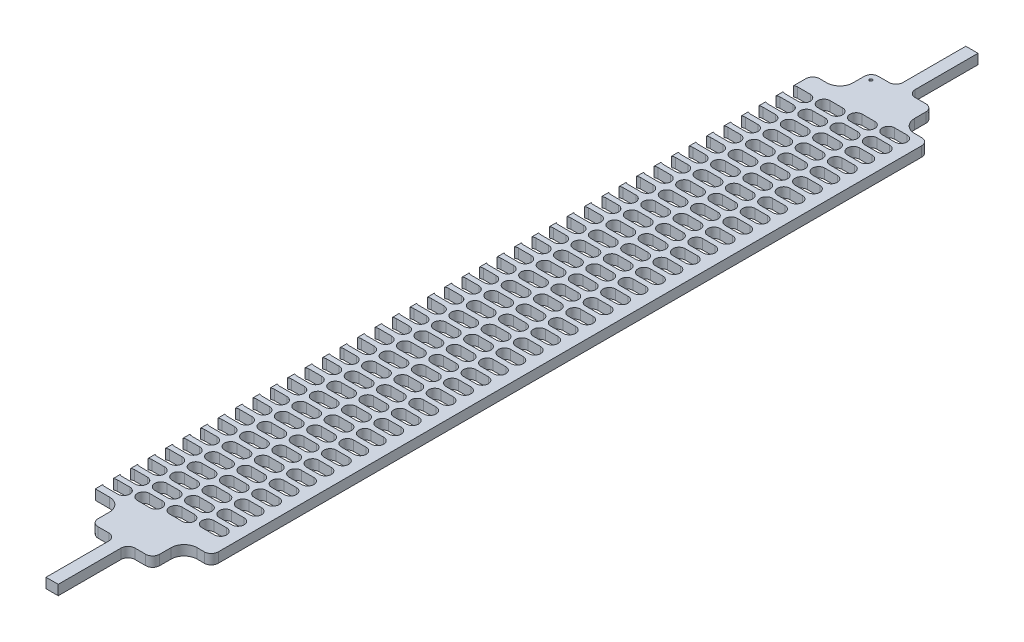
SolidWorks part; units mm, degrees
ref_plane "Alzado" through (0, 0, 0) normal (0, 0, 1) x (1, 0, 0)
ref_plane "Planta" through (0, 0, 0) normal (0, 1, 0) x (1, 0, 0)
ref_plane "Vista lateral" through (0, 0, 0) normal (1, 0, 0) x (0, 0, -1)
sketch "Croquis1" plane through (0, 0, 0) normal (0, 1, 0) x (1, 0, 0)
  line L0 (15.6, 411.2) -> (15.6, 429.2)
  line L1 (0, 0) -> (15.6, 0)
  line L2 (0, 0) -> (0, 4.2983)
  line L3 (0, 411.2) -> (15.6, 411.2)
  line L4 (66.5, 0) -> (66.5, 411.2)
  line L5 (15.6, 429.2) -> (29.75, 429.2)
  line L6 (29.75, 429.2) -> (29.75, 469.2)
  line L7 (29.75, 469.2) -> (36.75, 469.2)
  line L8 (36.75, 469.2) -> (36.75, 429.2)
  line L9 (36.75, 429.2) -> (50.9, 429.2)
  line L10 (50.9, 429.2) -> (50.9, 411.2)
  line L11 (50.9, 411.2) -> (66.5, 411.2)
  line L12 (15.6, 420.2) -> (50.9, 420.2) construction
  line L13 (50.9, 0) -> (50.9, -18)
  line L20 (50.9, -18) -> (36.75, -18)
  line L21 (36.75, -18) -> (36.75, -58)
  line L22 (36.75, -58) -> (29.75, -58)
  line L23 (29.75, -58) -> (29.75, -18)
  line L24 (29.75, -18) -> (15.6, -18)
  line L25 (15.6, -18) -> (15.6, 0)
  line L26 (50.9, 0) -> (66.5, 0)
  line L27 (15.6, -9) -> (50.9, -9) construction
  line L28 (49.8, 408.3) -> (57, 408.3)
  line L35 (49.8, 401.3) -> (57, 401.3)
  line L36 (33.8, 398.8) -> (41, 398.8)
  line L37 (33.8, 405.8) -> (41, 405.8)
  line L38 (17.8, 396.3) -> (25, 396.3)
  line L39 (17.8, 403.3) -> (25, 403.3)
  line L40 (1.8, 393.8) -> (9, 393.8)
  line L41 (1.8, 400.8) -> (9, 400.8)
  line L42 (0, 400.3017) -> (0, 411.2)
  line L43 (49.8, 398.3) -> (57, 398.3)
  line L44 (49.8, 391.3) -> (57, 391.3)
  line L45 (33.8, 395.8) -> (41, 395.8)
  line L46 (33.8, 388.8) -> (41, 388.8)
  line L47 (17.8, 393.3) -> (25, 393.3)
  line L48 (17.8, 386.3) -> (25, 386.3)
  line L49 (1.8, 390.8) -> (9, 390.8)
  line L50 (1.8, 383.8) -> (9, 383.8)
  line L51 (49.8, 388.3) -> (57, 388.3)
  line L52 (49.8, 381.3) -> (57, 381.3)
  line L53 (33.8, 385.8) -> (41, 385.8)
  line L54 (33.8, 378.8) -> (41, 378.8)
  line L55 (17.8, 383.3) -> (25, 383.3)
  line L56 (17.8, 376.3) -> (25, 376.3)
  line L57 (1.8, 380.8) -> (9, 380.8)
  line L58 (1.8, 373.8) -> (9, 373.8)
  line L59 (49.8, 378.3) -> (57, 378.3)
  line L60 (49.8, 371.3) -> (57, 371.3)
  line L61 (33.8, 375.8) -> (41, 375.8)
  line L62 (33.8, 368.8) -> (41, 368.8)
  line L63 (17.8, 373.3) -> (25, 373.3)
  line L64 (17.8, 366.3) -> (25, 366.3)
  line L65 (1.8, 370.8) -> (9, 370.8)
  line L66 (1.8, 363.8) -> (9, 363.8)
  line L67 (49.8, 368.3) -> (57, 368.3)
  line L68 (49.8, 361.3) -> (57, 361.3)
  line L69 (33.8, 365.8) -> (41, 365.8)
  line L70 (33.8, 358.8) -> (41, 358.8)
  line L71 (17.8, 363.3) -> (25, 363.3)
  line L72 (17.8, 356.3) -> (25, 356.3)
  line L73 (1.8, 360.8) -> (9, 360.8)
  line L74 (1.8, 353.8) -> (9, 353.8)
  line L75 (49.8, 358.3) -> (57, 358.3)
  line L76 (49.8, 351.3) -> (57, 351.3)
  line L77 (33.8, 355.8) -> (41, 355.8)
  line L78 (33.8, 348.8) -> (41, 348.8)
  line L79 (17.8, 353.3) -> (25, 353.3)
  line L80 (17.8, 346.3) -> (25, 346.3)
  line L81 (1.8, 350.8) -> (9, 350.8)
  line L82 (1.8, 343.8) -> (9, 343.8)
  line L83 (49.8, 348.3) -> (57, 348.3)
  line L84 (49.8, 341.3) -> (57, 341.3)
  line L85 (33.8, 345.8) -> (41, 345.8)
  line L86 (33.8, 338.8) -> (41, 338.8)
  line L87 (17.8, 343.3) -> (25, 343.3)
  line L88 (17.8, 336.3) -> (25, 336.3)
  line L89 (1.8, 340.8) -> (9, 340.8)
  line L90 (1.8, 333.8) -> (9, 333.8)
  line L91 (49.8, 338.3) -> (57, 338.3)
  line L92 (49.8, 331.3) -> (57, 331.3)
  line L93 (33.8, 335.8) -> (41, 335.8)
  line L94 (33.8, 328.8) -> (41, 328.8)
  line L95 (17.8, 333.3) -> (25, 333.3)
  line L96 (17.8, 326.3) -> (25, 326.3)
  line L97 (1.8, 330.8) -> (9, 330.8)
  line L98 (1.8, 323.8) -> (9, 323.8)
  line L99 (49.8, 328.3) -> (57, 328.3)
  line L100 (49.8, 321.3) -> (57, 321.3)
  line L101 (33.8, 325.8) -> (41, 325.8)
  line L102 (33.8, 318.8) -> (41, 318.8)
  line L103 (17.8, 323.3) -> (25, 323.3)
  line L104 (17.8, 316.3) -> (25, 316.3)
  line L105 (1.8, 320.8) -> (9, 320.8)
  line L106 (1.8, 313.8) -> (9, 313.8)
  line L107 (49.8, 318.3) -> (57, 318.3)
  line L108 (49.8, 311.3) -> (57, 311.3)
  line L109 (33.8, 315.8) -> (41, 315.8)
  line L110 (33.8, 308.8) -> (41, 308.8)
  line L111 (17.8, 313.3) -> (25, 313.3)
  line L112 (17.8, 306.3) -> (25, 306.3)
  line L113 (1.8, 310.8) -> (9, 310.8)
  line L114 (1.8, 303.8) -> (9, 303.8)
  line L115 (49.8, 308.3) -> (57, 308.3)
  line L116 (49.8, 301.3) -> (57, 301.3)
  line L117 (33.8, 305.8) -> (41, 305.8)
  line L118 (33.8, 298.8) -> (41, 298.8)
  line L119 (17.8, 303.3) -> (25, 303.3)
  line L120 (17.8, 296.3) -> (25, 296.3)
  line L121 (1.8, 300.8) -> (9, 300.8)
  line L122 (1.8, 293.8) -> (9, 293.8)
  line L123 (49.8, 298.3) -> (57, 298.3)
  line L124 (49.8, 291.3) -> (57, 291.3)
  line L125 (33.8, 295.8) -> (41, 295.8)
  line L126 (33.8, 288.8) -> (41, 288.8)
  line L127 (17.8, 293.3) -> (25, 293.3)
  line L128 (17.8, 286.3) -> (25, 286.3)
  line L129 (1.8, 290.8) -> (9, 290.8)
  line L130 (1.8, 283.8) -> (9, 283.8)
  line L131 (49.8, 288.3) -> (57, 288.3)
  line L132 (49.8, 281.3) -> (57, 281.3)
  line L133 (33.8, 285.8) -> (41, 285.8)
  line L134 (33.8, 278.8) -> (41, 278.8)
  line L135 (17.8, 283.3) -> (25, 283.3)
  line L136 (17.8, 276.3) -> (25, 276.3)
  line L137 (1.8, 280.8) -> (9, 280.8)
  line L138 (1.8, 273.8) -> (9, 273.8)
  line L139 (49.8, 278.3) -> (57, 278.3)
  line L140 (49.8, 271.3) -> (57, 271.3)
  line L141 (33.8, 275.8) -> (41, 275.8)
  line L142 (33.8, 268.8) -> (41, 268.8)
  line L143 (17.8, 273.3) -> (25, 273.3)
  line L144 (17.8, 266.3) -> (25, 266.3)
  line L145 (1.8, 270.8) -> (9, 270.8)
  line L146 (1.8, 263.8) -> (9, 263.8)
  line L147 (49.8, 268.3) -> (57, 268.3)
  line L148 (49.8, 261.3) -> (57, 261.3)
  line L149 (33.8, 265.8) -> (41, 265.8)
  line L150 (33.8, 258.8) -> (41, 258.8)
  line L151 (17.8, 263.3) -> (25, 263.3)
  line L152 (17.8, 256.3) -> (25, 256.3)
  line L153 (1.8, 260.8) -> (9, 260.8)
  line L154 (1.8, 253.8) -> (9, 253.8)
  line L155 (49.8, 258.3) -> (57, 258.3)
  line L156 (49.8, 251.3) -> (57, 251.3)
  line L157 (33.8, 255.8) -> (41, 255.8)
  line L158 (33.8, 248.8) -> (41, 248.8)
  line L159 (17.8, 253.3) -> (25, 253.3)
  line L160 (17.8, 246.3) -> (25, 246.3)
  line L161 (1.8, 250.8) -> (9, 250.8)
  line L162 (1.8, 243.8) -> (9, 243.8)
  line L163 (49.8, 248.3) -> (57, 248.3)
  line L164 (49.8, 241.3) -> (57, 241.3)
  line L165 (33.8, 245.8) -> (41, 245.8)
  line L166 (33.8, 238.8) -> (41, 238.8)
  line L167 (17.8, 243.3) -> (25, 243.3)
  line L168 (17.8, 236.3) -> (25, 236.3)
  line L169 (1.8, 240.8) -> (9, 240.8)
  line L170 (1.8, 233.8) -> (9, 233.8)
  line L171 (49.8, 238.3) -> (57, 238.3)
  line L172 (49.8, 231.3) -> (57, 231.3)
  line L173 (33.8, 235.8) -> (41, 235.8)
  line L174 (33.8, 228.8) -> (41, 228.8)
  line L175 (17.8, 233.3) -> (25, 233.3)
  line L176 (17.8, 226.3) -> (25, 226.3)
  line L177 (1.8, 230.8) -> (9, 230.8)
  line L178 (1.8, 223.8) -> (9, 223.8)
  line L179 (49.8, 228.3) -> (57, 228.3)
  line L180 (49.8, 221.3) -> (57, 221.3)
  line L181 (33.8, 225.8) -> (41, 225.8)
  line L182 (33.8, 218.8) -> (41, 218.8)
  line L183 (17.8, 223.3) -> (25, 223.3)
  line L184 (17.8, 216.3) -> (25, 216.3)
  line L185 (1.8, 220.8) -> (9, 220.8)
  line L186 (1.8, 213.8) -> (9, 213.8)
  line L187 (49.8, 218.3) -> (57, 218.3)
  line L188 (49.8, 211.3) -> (57, 211.3)
  line L189 (33.8, 215.8) -> (41, 215.8)
  line L190 (33.8, 208.8) -> (41, 208.8)
  line L191 (17.8, 213.3) -> (25, 213.3)
  line L192 (17.8, 206.3) -> (25, 206.3)
  line L193 (1.8, 210.8) -> (9, 210.8)
  line L194 (1.8, 203.8) -> (9, 203.8)
  line L195 (49.8, 208.3) -> (57, 208.3)
  line L196 (49.8, 201.3) -> (57, 201.3)
  line L197 (33.8, 205.8) -> (41, 205.8)
  line L198 (33.8, 198.8) -> (41, 198.8)
  line L199 (17.8, 203.3) -> (25, 203.3)
  line L200 (17.8, 196.3) -> (25, 196.3)
  line L201 (1.8, 200.8) -> (9, 200.8)
  line L202 (1.8, 193.8) -> (9, 193.8)
  line L203 (49.8, 198.3) -> (57, 198.3)
  line L204 (49.8, 191.3) -> (57, 191.3)
  line L205 (33.8, 195.8) -> (41, 195.8)
  line L206 (33.8, 188.8) -> (41, 188.8)
  line L207 (17.8, 193.3) -> (25, 193.3)
  line L208 (17.8, 186.3) -> (25, 186.3)
  line L209 (1.8, 190.8) -> (9, 190.8)
  line L210 (1.8, 183.8) -> (9, 183.8)
  line L211 (49.8, 188.3) -> (57, 188.3)
  line L212 (49.8, 181.3) -> (57, 181.3)
  line L213 (33.8, 185.8) -> (41, 185.8)
  line L214 (33.8, 178.8) -> (41, 178.8)
  line L215 (17.8, 183.3) -> (25, 183.3)
  line L216 (17.8, 176.3) -> (25, 176.3)
  line L217 (1.8, 180.8) -> (9, 180.8)
  line L218 (1.8, 173.8) -> (9, 173.8)
  line L219 (49.8, 178.3) -> (57, 178.3)
  line L220 (49.8, 171.3) -> (57, 171.3)
  line L221 (33.8, 175.8) -> (41, 175.8)
  line L222 (33.8, 168.8) -> (41, 168.8)
  line L223 (17.8, 173.3) -> (25, 173.3)
  line L224 (17.8, 166.3) -> (25, 166.3)
  line L225 (1.8, 170.8) -> (9, 170.8)
  line L226 (1.8, 163.8) -> (9, 163.8)
  line L227 (49.8, 168.3) -> (57, 168.3)
  line L228 (49.8, 161.3) -> (57, 161.3)
  line L229 (33.8, 165.8) -> (41, 165.8)
  line L230 (33.8, 158.8) -> (41, 158.8)
  line L231 (17.8, 163.3) -> (25, 163.3)
  line L232 (17.8, 156.3) -> (25, 156.3)
  line L233 (1.8, 160.8) -> (9, 160.8)
  line L234 (1.8, 153.8) -> (9, 153.8)
  line L235 (49.8, 158.3) -> (57, 158.3)
  line L236 (49.8, 151.3) -> (57, 151.3)
  line L237 (33.8, 155.8) -> (41, 155.8)
  line L238 (33.8, 148.8) -> (41, 148.8)
  line L239 (17.8, 153.3) -> (25, 153.3)
  line L240 (17.8, 146.3) -> (25, 146.3)
  line L241 (1.8, 150.8) -> (9, 150.8)
  line L242 (1.8, 143.8) -> (9, 143.8)
  line L243 (49.8, 148.3) -> (57, 148.3)
  line L244 (49.8, 141.3) -> (57, 141.3)
  line L245 (33.8, 145.8) -> (41, 145.8)
  line L246 (33.8, 138.8) -> (41, 138.8)
  line L247 (17.8, 143.3) -> (25, 143.3)
  line L248 (17.8, 136.3) -> (25, 136.3)
  line L249 (1.8, 140.8) -> (9, 140.8)
  line L250 (1.8, 133.8) -> (9, 133.8)
  line L251 (49.8, 138.3) -> (57, 138.3)
  line L252 (49.8, 131.3) -> (57, 131.3)
  line L253 (33.8, 135.8) -> (41, 135.8)
  line L254 (33.8, 128.8) -> (41, 128.8)
  line L255 (17.8, 133.3) -> (25, 133.3)
  line L256 (17.8, 126.3) -> (25, 126.3)
  line L257 (1.8, 130.8) -> (9, 130.8)
  line L258 (1.8, 123.8) -> (9, 123.8)
  line L259 (49.8, 128.3) -> (57, 128.3)
  line L260 (49.8, 121.3) -> (57, 121.3)
  line L261 (33.8, 125.8) -> (41, 125.8)
  line L262 (33.8, 118.8) -> (41, 118.8)
  line L263 (17.8, 123.3) -> (25, 123.3)
  line L264 (17.8, 116.3) -> (25, 116.3)
  line L265 (1.8, 120.8) -> (9, 120.8)
  line L266 (1.8, 113.8) -> (9, 113.8)
  line L267 (49.8, 118.3) -> (57, 118.3)
  line L268 (49.8, 111.3) -> (57, 111.3)
  line L269 (33.8, 115.8) -> (41, 115.8)
  line L270 (33.8, 108.8) -> (41, 108.8)
  line L271 (17.8, 113.3) -> (25, 113.3)
  line L272 (17.8, 106.3) -> (25, 106.3)
  line L273 (1.8, 110.8) -> (9, 110.8)
  line L274 (1.8, 103.8) -> (9, 103.8)
  line L275 (49.8, 108.3) -> (57, 108.3)
  line L276 (49.8, 101.3) -> (57, 101.3)
  line L277 (33.8, 105.8) -> (41, 105.8)
  line L278 (33.8, 98.8) -> (41, 98.8)
  line L279 (17.8, 103.3) -> (25, 103.3)
  line L280 (17.8, 96.3) -> (25, 96.3)
  line L281 (1.8, 100.8) -> (9, 100.8)
  line L282 (1.8, 93.8) -> (9, 93.8)
  line L283 (49.8, 98.3) -> (57, 98.3)
  line L284 (49.8, 91.3) -> (57, 91.3)
  line L285 (33.8, 95.8) -> (41, 95.8)
  line L286 (33.8, 88.8) -> (41, 88.8)
  line L287 (17.8, 93.3) -> (25, 93.3)
  line L288 (17.8, 86.3) -> (25, 86.3)
  line L289 (1.8, 90.8) -> (9, 90.8)
  line L290 (1.8, 83.8) -> (9, 83.8)
  line L291 (49.8, 88.3) -> (57, 88.3)
  line L292 (49.8, 81.3) -> (57, 81.3)
  line L293 (33.8, 85.8) -> (41, 85.8)
  line L294 (33.8, 78.8) -> (41, 78.8)
  line L295 (17.8, 83.3) -> (25, 83.3)
  line L296 (17.8, 76.3) -> (25, 76.3)
  line L297 (1.8, 80.8) -> (9, 80.8)
  line L298 (1.8, 73.8) -> (9, 73.8)
  line L299 (49.8, 78.3) -> (57, 78.3)
  line L300 (49.8, 71.3) -> (57, 71.3)
  line L301 (33.8, 75.8) -> (41, 75.8)
  line L302 (33.8, 68.8) -> (41, 68.8)
  line L303 (17.8, 73.3) -> (25, 73.3)
  line L304 (17.8, 66.3) -> (25, 66.3)
  line L305 (1.8, 70.8) -> (9, 70.8)
  line L306 (1.8, 63.8) -> (9, 63.8)
  line L307 (49.8, 68.3) -> (57, 68.3)
  line L308 (49.8, 61.3) -> (57, 61.3)
  line L309 (33.8, 65.8) -> (41, 65.8)
  line L310 (33.8, 58.8) -> (41, 58.8)
  line L311 (17.8, 63.3) -> (25, 63.3)
  line L312 (17.8, 56.3) -> (25, 56.3)
  line L313 (1.8, 60.8) -> (9, 60.8)
  line L314 (1.8, 53.8) -> (9, 53.8)
  line L315 (49.8, 58.3) -> (57, 58.3)
  line L316 (49.8, 51.3) -> (57, 51.3)
  line L317 (33.8, 55.8) -> (41, 55.8)
  line L318 (33.8, 48.8) -> (41, 48.8)
  line L319 (17.8, 53.3) -> (25, 53.3)
  line L320 (17.8, 46.3) -> (25, 46.3)
  line L321 (1.8, 50.8) -> (9, 50.8)
  line L322 (1.8, 43.8) -> (9, 43.8)
  line L323 (49.8, 48.3) -> (57, 48.3)
  line L324 (49.8, 41.3) -> (57, 41.3)
  line L325 (33.8, 45.8) -> (41, 45.8)
  line L326 (33.8, 38.8) -> (41, 38.8)
  line L327 (17.8, 43.3) -> (25, 43.3)
  line L328 (17.8, 36.3) -> (25, 36.3)
  line L329 (1.8, 40.8) -> (9, 40.8)
  line L330 (1.8, 33.8) -> (9, 33.8)
  line L331 (49.8, 38.3) -> (57, 38.3)
  line L332 (49.8, 31.3) -> (57, 31.3)
  line L333 (33.8, 35.8) -> (41, 35.8)
  line L334 (33.8, 28.8) -> (41, 28.8)
  line L335 (17.8, 33.3) -> (25, 33.3)
  line L336 (17.8, 26.3) -> (25, 26.3)
  line L337 (1.8, 30.8) -> (9, 30.8)
  line L338 (1.8, 23.8) -> (9, 23.8)
  line L339 (49.8, 28.3) -> (57, 28.3)
  line L340 (49.8, 21.3) -> (57, 21.3)
  line L341 (33.8, 25.8) -> (41, 25.8)
  line L342 (33.8, 18.8) -> (41, 18.8)
  line L343 (17.8, 23.3) -> (25, 23.3)
  line L344 (17.8, 16.3) -> (25, 16.3)
  line L345 (1.8, 20.8) -> (9, 20.8)
  line L346 (1.8, 13.8) -> (9, 13.8)
  line L347 (49.8, 18.3) -> (57, 18.3)
  line L348 (49.8, 11.3) -> (57, 11.3)
  line L349 (33.8, 15.8) -> (41, 15.8)
  line L350 (33.8, 8.8) -> (41, 8.8)
  line L351 (17.8, 13.3) -> (25, 13.3)
  line L352 (17.8, 6.3) -> (25, 6.3)
  line L353 (1.8, 10.8) -> (9, 10.8)
  line L354 (1.8, 3.8) -> (9, 3.8)
  line L355 (0, 10.3017) -> (0, 14.2983)
  line L356 (0, 20.3017) -> (0, 24.2983)
  line L357 (0, 30.3017) -> (0, 34.2983)
  line L358 (0, 40.3017) -> (0, 44.2983)
  line L359 (0, 50.3017) -> (0, 54.2983)
  line L360 (0, 60.3017) -> (0, 64.2983)
  line L361 (0, 70.3017) -> (0, 74.2983)
  line L362 (0, 80.3017) -> (0, 84.2983)
  line L363 (0, 90.3017) -> (0, 94.2983)
  line L364 (0, 100.3017) -> (0, 104.2983)
  line L365 (0, 110.3017) -> (0, 114.2983)
  line L366 (0, 120.3017) -> (0, 124.2983)
  line L367 (0, 130.3017) -> (0, 134.2983)
  line L368 (0, 140.3017) -> (0, 144.2983)
  line L369 (0, 150.3017) -> (0, 154.2983)
  line L370 (0, 160.3017) -> (0, 164.2983)
  line L371 (0, 170.3017) -> (0, 174.2983)
  line L372 (0, 180.3017) -> (0, 184.2983)
  line L373 (0, 190.3017) -> (0, 194.2983)
  line L374 (0, 200.3017) -> (0, 204.2983)
  line L375 (0, 210.3017) -> (0, 214.2983)
  line L376 (0, 220.3017) -> (0, 224.2983)
  line L377 (0, 230.3017) -> (0, 234.2983)
  line L378 (0, 240.3017) -> (0, 244.2983)
  line L379 (0, 250.3017) -> (0, 254.2983)
  line L380 (0, 260.3017) -> (0, 264.2983)
  line L381 (0, 270.3017) -> (0, 274.2983)
  line L382 (0, 280.3017) -> (0, 284.2983)
  line L383 (0, 290.3017) -> (0, 294.2983)
  line L384 (0, 300.3017) -> (0, 304.2983)
  line L385 (0, 310.3017) -> (0, 314.2983)
  line L386 (0, 320.3017) -> (0, 324.2983)
  line L387 (0, 330.3017) -> (0, 334.2983)
  line L388 (0, 340.3017) -> (0, 344.2983)
  line L389 (0, 350.3017) -> (0, 354.2983)
  line L390 (0, 360.3017) -> (0, 364.2983)
  line L391 (0, 370.3017) -> (0, 374.2983)
  line L392 (0, 380.3017) -> (0, 384.2983)
  line L393 (0, 390.3017) -> (0, 394.2983)
  arc A0 (57, 401.3) -> (57, 408.3) centre (57, 404.8) ccw
  arc A1 (49.8, 408.3) -> (49.8, 401.3) centre (49.8, 404.8) ccw
  arc A2 (41, 398.8) -> (41, 405.8) centre (41, 402.3) ccw
  arc A3 (33.8, 405.8) -> (33.8, 398.8) centre (33.8, 402.3) ccw
  arc A4 (25, 396.3) -> (25, 403.3) centre (25, 399.8) ccw
  arc A5 (17.8, 403.3) -> (17.8, 396.3) centre (17.8, 399.8) ccw
  arc A6 (9, 393.8) -> (9, 400.8) centre (9, 397.3) ccw
  arc A7 (1.8, 400.8) -> (0, 400.3017) centre (1.8, 397.3) ccw
  arc A8 (0, 394.2983) -> (1.8, 393.8) centre (1.8, 397.3) ccw
  arc A9 (57, 391.3) -> (57, 398.3) centre (57, 394.8) ccw
  arc A10 (49.8, 398.3) -> (49.8, 391.3) centre (49.8, 394.8) ccw
  arc A11 (41, 388.8) -> (41, 395.8) centre (41, 392.3) ccw
  arc A12 (33.8, 395.8) -> (33.8, 388.8) centre (33.8, 392.3) ccw
  arc A13 (25, 386.3) -> (25, 393.3) centre (25, 389.8) ccw
  arc A14 (17.8, 393.3) -> (17.8, 386.3) centre (17.8, 389.8) ccw
  arc A15 (9, 383.8) -> (9, 390.8) centre (9, 387.3) ccw
  arc A16 (1.8, 390.8) -> (0, 390.3017) centre (1.8, 387.3) ccw
  arc A17 (0, 384.2983) -> (1.8, 383.8) centre (1.8, 387.3) ccw
  arc A18 (57, 381.3) -> (57, 388.3) centre (57, 384.8) ccw
  arc A19 (49.8, 388.3) -> (49.8, 381.3) centre (49.8, 384.8) ccw
  arc A20 (41, 378.8) -> (41, 385.8) centre (41, 382.3) ccw
  arc A21 (33.8, 385.8) -> (33.8, 378.8) centre (33.8, 382.3) ccw
  arc A22 (25, 376.3) -> (25, 383.3) centre (25, 379.8) ccw
  arc A23 (17.8, 383.3) -> (17.8, 376.3) centre (17.8, 379.8) ccw
  arc A24 (9, 373.8) -> (9, 380.8) centre (9, 377.3) ccw
  arc A25 (1.8, 380.8) -> (0, 380.3017) centre (1.8, 377.3) ccw
  arc A26 (0, 374.2983) -> (1.8, 373.8) centre (1.8, 377.3) ccw
  arc A27 (57, 371.3) -> (57, 378.3) centre (57, 374.8) ccw
  arc A28 (49.8, 378.3) -> (49.8, 371.3) centre (49.8, 374.8) ccw
  arc A29 (41, 368.8) -> (41, 375.8) centre (41, 372.3) ccw
  arc A30 (33.8, 375.8) -> (33.8, 368.8) centre (33.8, 372.3) ccw
  arc A31 (25, 366.3) -> (25, 373.3) centre (25, 369.8) ccw
  arc A32 (17.8, 373.3) -> (17.8, 366.3) centre (17.8, 369.8) ccw
  arc A33 (9, 363.8) -> (9, 370.8) centre (9, 367.3) ccw
  arc A34 (1.8, 370.8) -> (0, 370.3017) centre (1.8, 367.3) ccw
  arc A35 (0, 364.2983) -> (1.8, 363.8) centre (1.8, 367.3) ccw
  arc A36 (57, 361.3) -> (57, 368.3) centre (57, 364.8) ccw
  arc A37 (49.8, 368.3) -> (49.8, 361.3) centre (49.8, 364.8) ccw
  arc A38 (41, 358.8) -> (41, 365.8) centre (41, 362.3) ccw
  arc A39 (33.8, 365.8) -> (33.8, 358.8) centre (33.8, 362.3) ccw
  arc A40 (25, 356.3) -> (25, 363.3) centre (25, 359.8) ccw
  arc A41 (17.8, 363.3) -> (17.8, 356.3) centre (17.8, 359.8) ccw
  arc A42 (9, 353.8) -> (9, 360.8) centre (9, 357.3) ccw
  arc A43 (1.8, 360.8) -> (0, 360.3017) centre (1.8, 357.3) ccw
  arc A44 (0, 354.2983) -> (1.8, 353.8) centre (1.8, 357.3) ccw
  arc A45 (57, 351.3) -> (57, 358.3) centre (57, 354.8) ccw
  arc A46 (49.8, 358.3) -> (49.8, 351.3) centre (49.8, 354.8) ccw
  arc A47 (41, 348.8) -> (41, 355.8) centre (41, 352.3) ccw
  arc A48 (33.8, 355.8) -> (33.8, 348.8) centre (33.8, 352.3) ccw
  arc A49 (25, 346.3) -> (25, 353.3) centre (25, 349.8) ccw
  arc A50 (17.8, 353.3) -> (17.8, 346.3) centre (17.8, 349.8) ccw
  arc A51 (9, 343.8) -> (9, 350.8) centre (9, 347.3) ccw
  arc A52 (1.8, 350.8) -> (0, 350.3017) centre (1.8, 347.3) ccw
  arc A53 (0, 344.2983) -> (1.8, 343.8) centre (1.8, 347.3) ccw
  arc A54 (57, 341.3) -> (57, 348.3) centre (57, 344.8) ccw
  arc A55 (49.8, 348.3) -> (49.8, 341.3) centre (49.8, 344.8) ccw
  arc A56 (41, 338.8) -> (41, 345.8) centre (41, 342.3) ccw
  arc A57 (33.8, 345.8) -> (33.8, 338.8) centre (33.8, 342.3) ccw
  arc A58 (25, 336.3) -> (25, 343.3) centre (25, 339.8) ccw
  arc A59 (17.8, 343.3) -> (17.8, 336.3) centre (17.8, 339.8) ccw
  arc A60 (9, 333.8) -> (9, 340.8) centre (9, 337.3) ccw
  arc A61 (1.8, 340.8) -> (0, 340.3017) centre (1.8, 337.3) ccw
  arc A62 (0, 334.2983) -> (1.8, 333.8) centre (1.8, 337.3) ccw
  arc A63 (57, 331.3) -> (57, 338.3) centre (57, 334.8) ccw
  arc A64 (49.8, 338.3) -> (49.8, 331.3) centre (49.8, 334.8) ccw
  arc A65 (41, 328.8) -> (41, 335.8) centre (41, 332.3) ccw
  arc A66 (33.8, 335.8) -> (33.8, 328.8) centre (33.8, 332.3) ccw
  arc A67 (25, 326.3) -> (25, 333.3) centre (25, 329.8) ccw
  arc A68 (17.8, 333.3) -> (17.8, 326.3) centre (17.8, 329.8) ccw
  arc A69 (9, 323.8) -> (9, 330.8) centre (9, 327.3) ccw
  arc A70 (1.8, 330.8) -> (0, 330.3017) centre (1.8, 327.3) ccw
  arc A71 (0, 324.2983) -> (1.8, 323.8) centre (1.8, 327.3) ccw
  arc A72 (57, 321.3) -> (57, 328.3) centre (57, 324.8) ccw
  arc A73 (49.8, 328.3) -> (49.8, 321.3) centre (49.8, 324.8) ccw
  arc A74 (41, 318.8) -> (41, 325.8) centre (41, 322.3) ccw
  arc A75 (33.8, 325.8) -> (33.8, 318.8) centre (33.8, 322.3) ccw
  arc A76 (25, 316.3) -> (25, 323.3) centre (25, 319.8) ccw
  arc A77 (17.8, 323.3) -> (17.8, 316.3) centre (17.8, 319.8) ccw
  arc A78 (9, 313.8) -> (9, 320.8) centre (9, 317.3) ccw
  arc A79 (1.8, 320.8) -> (0, 320.3017) centre (1.8, 317.3) ccw
  arc A80 (0, 314.2983) -> (1.8, 313.8) centre (1.8, 317.3) ccw
  arc A81 (57, 311.3) -> (57, 318.3) centre (57, 314.8) ccw
  arc A82 (49.8, 318.3) -> (49.8, 311.3) centre (49.8, 314.8) ccw
  arc A83 (41, 308.8) -> (41, 315.8) centre (41, 312.3) ccw
  arc A84 (33.8, 315.8) -> (33.8, 308.8) centre (33.8, 312.3) ccw
  arc A85 (25, 306.3) -> (25, 313.3) centre (25, 309.8) ccw
  arc A86 (17.8, 313.3) -> (17.8, 306.3) centre (17.8, 309.8) ccw
  arc A87 (9, 303.8) -> (9, 310.8) centre (9, 307.3) ccw
  arc A88 (1.8, 310.8) -> (0, 310.3017) centre (1.8, 307.3) ccw
  arc A89 (0, 304.2983) -> (1.8, 303.8) centre (1.8, 307.3) ccw
  arc A90 (57, 301.3) -> (57, 308.3) centre (57, 304.8) ccw
  arc A91 (49.8, 308.3) -> (49.8, 301.3) centre (49.8, 304.8) ccw
  arc A92 (41, 298.8) -> (41, 305.8) centre (41, 302.3) ccw
  arc A93 (33.8, 305.8) -> (33.8, 298.8) centre (33.8, 302.3) ccw
  arc A94 (25, 296.3) -> (25, 303.3) centre (25, 299.8) ccw
  arc A95 (17.8, 303.3) -> (17.8, 296.3) centre (17.8, 299.8) ccw
  arc A96 (9, 293.8) -> (9, 300.8) centre (9, 297.3) ccw
  arc A97 (1.8, 300.8) -> (0, 300.3017) centre (1.8, 297.3) ccw
  arc A98 (0, 294.2983) -> (1.8, 293.8) centre (1.8, 297.3) ccw
  arc A99 (57, 291.3) -> (57, 298.3) centre (57, 294.8) ccw
  arc A100 (49.8, 298.3) -> (49.8, 291.3) centre (49.8, 294.8) ccw
  arc A101 (41, 288.8) -> (41, 295.8) centre (41, 292.3) ccw
  arc A102 (33.8, 295.8) -> (33.8, 288.8) centre (33.8, 292.3) ccw
  arc A103 (25, 286.3) -> (25, 293.3) centre (25, 289.8) ccw
  arc A104 (17.8, 293.3) -> (17.8, 286.3) centre (17.8, 289.8) ccw
  arc A105 (9, 283.8) -> (9, 290.8) centre (9, 287.3) ccw
  arc A106 (1.8, 290.8) -> (0, 290.3017) centre (1.8, 287.3) ccw
  arc A107 (0, 284.2983) -> (1.8, 283.8) centre (1.8, 287.3) ccw
  arc A108 (57, 281.3) -> (57, 288.3) centre (57, 284.8) ccw
  arc A109 (49.8, 288.3) -> (49.8, 281.3) centre (49.8, 284.8) ccw
  arc A110 (41, 278.8) -> (41, 285.8) centre (41, 282.3) ccw
  arc A111 (33.8, 285.8) -> (33.8, 278.8) centre (33.8, 282.3) ccw
  arc A112 (25, 276.3) -> (25, 283.3) centre (25, 279.8) ccw
  arc A113 (17.8, 283.3) -> (17.8, 276.3) centre (17.8, 279.8) ccw
  arc A114 (9, 273.8) -> (9, 280.8) centre (9, 277.3) ccw
  arc A115 (1.8, 280.8) -> (0, 280.3017) centre (1.8, 277.3) ccw
  arc A116 (0, 274.2983) -> (1.8, 273.8) centre (1.8, 277.3) ccw
  arc A117 (57, 271.3) -> (57, 278.3) centre (57, 274.8) ccw
  arc A118 (49.8, 278.3) -> (49.8, 271.3) centre (49.8, 274.8) ccw
  arc A119 (41, 268.8) -> (41, 275.8) centre (41, 272.3) ccw
  arc A120 (33.8, 275.8) -> (33.8, 268.8) centre (33.8, 272.3) ccw
  arc A121 (25, 266.3) -> (25, 273.3) centre (25, 269.8) ccw
  arc A122 (17.8, 273.3) -> (17.8, 266.3) centre (17.8, 269.8) ccw
  arc A123 (9, 263.8) -> (9, 270.8) centre (9, 267.3) ccw
  arc A124 (1.8, 270.8) -> (0, 270.3017) centre (1.8, 267.3) ccw
  arc A125 (0, 264.2983) -> (1.8, 263.8) centre (1.8, 267.3) ccw
  arc A126 (57, 261.3) -> (57, 268.3) centre (57, 264.8) ccw
  arc A127 (49.8, 268.3) -> (49.8, 261.3) centre (49.8, 264.8) ccw
  arc A128 (41, 258.8) -> (41, 265.8) centre (41, 262.3) ccw
  arc A129 (33.8, 265.8) -> (33.8, 258.8) centre (33.8, 262.3) ccw
  arc A130 (25, 256.3) -> (25, 263.3) centre (25, 259.8) ccw
  arc A131 (17.8, 263.3) -> (17.8, 256.3) centre (17.8, 259.8) ccw
  arc A132 (9, 253.8) -> (9, 260.8) centre (9, 257.3) ccw
  arc A133 (1.8, 260.8) -> (0, 260.3017) centre (1.8, 257.3) ccw
  arc A134 (0, 254.2983) -> (1.8, 253.8) centre (1.8, 257.3) ccw
  arc A135 (57, 251.3) -> (57, 258.3) centre (57, 254.8) ccw
  arc A136 (49.8, 258.3) -> (49.8, 251.3) centre (49.8, 254.8) ccw
  arc A137 (41, 248.8) -> (41, 255.8) centre (41, 252.3) ccw
  arc A138 (33.8, 255.8) -> (33.8, 248.8) centre (33.8, 252.3) ccw
  arc A139 (25, 246.3) -> (25, 253.3) centre (25, 249.8) ccw
  arc A140 (17.8, 253.3) -> (17.8, 246.3) centre (17.8, 249.8) ccw
  arc A141 (9, 243.8) -> (9, 250.8) centre (9, 247.3) ccw
  arc A142 (1.8, 250.8) -> (0, 250.3017) centre (1.8, 247.3) ccw
  arc A143 (0, 244.2983) -> (1.8, 243.8) centre (1.8, 247.3) ccw
  arc A144 (57, 241.3) -> (57, 248.3) centre (57, 244.8) ccw
  arc A145 (49.8, 248.3) -> (49.8, 241.3) centre (49.8, 244.8) ccw
  arc A146 (41, 238.8) -> (41, 245.8) centre (41, 242.3) ccw
  arc A147 (33.8, 245.8) -> (33.8, 238.8) centre (33.8, 242.3) ccw
  arc A148 (25, 236.3) -> (25, 243.3) centre (25, 239.8) ccw
  arc A149 (17.8, 243.3) -> (17.8, 236.3) centre (17.8, 239.8) ccw
  arc A150 (9, 233.8) -> (9, 240.8) centre (9, 237.3) ccw
  arc A151 (1.8, 240.8) -> (0, 240.3017) centre (1.8, 237.3) ccw
  arc A152 (0, 234.2983) -> (1.8, 233.8) centre (1.8, 237.3) ccw
  arc A153 (57, 231.3) -> (57, 238.3) centre (57, 234.8) ccw
  arc A154 (49.8, 238.3) -> (49.8, 231.3) centre (49.8, 234.8) ccw
  arc A155 (41, 228.8) -> (41, 235.8) centre (41, 232.3) ccw
  arc A156 (33.8, 235.8) -> (33.8, 228.8) centre (33.8, 232.3) ccw
  arc A157 (25, 226.3) -> (25, 233.3) centre (25, 229.8) ccw
  arc A158 (17.8, 233.3) -> (17.8, 226.3) centre (17.8, 229.8) ccw
  arc A159 (9, 223.8) -> (9, 230.8) centre (9, 227.3) ccw
  arc A160 (1.8, 230.8) -> (0, 230.3017) centre (1.8, 227.3) ccw
  arc A161 (0, 224.2983) -> (1.8, 223.8) centre (1.8, 227.3) ccw
  arc A162 (57, 221.3) -> (57, 228.3) centre (57, 224.8) ccw
  arc A163 (49.8, 228.3) -> (49.8, 221.3) centre (49.8, 224.8) ccw
  arc A164 (41, 218.8) -> (41, 225.8) centre (41, 222.3) ccw
  arc A165 (33.8, 225.8) -> (33.8, 218.8) centre (33.8, 222.3) ccw
  arc A166 (25, 216.3) -> (25, 223.3) centre (25, 219.8) ccw
  arc A167 (17.8, 223.3) -> (17.8, 216.3) centre (17.8, 219.8) ccw
  arc A168 (9, 213.8) -> (9, 220.8) centre (9, 217.3) ccw
  arc A169 (1.8, 220.8) -> (0, 220.3017) centre (1.8, 217.3) ccw
  arc A170 (0, 214.2983) -> (1.8, 213.8) centre (1.8, 217.3) ccw
  arc A171 (57, 211.3) -> (57, 218.3) centre (57, 214.8) ccw
  arc A172 (49.8, 218.3) -> (49.8, 211.3) centre (49.8, 214.8) ccw
  arc A173 (41, 208.8) -> (41, 215.8) centre (41, 212.3) ccw
  arc A174 (33.8, 215.8) -> (33.8, 208.8) centre (33.8, 212.3) ccw
  arc A175 (25, 206.3) -> (25, 213.3) centre (25, 209.8) ccw
  arc A176 (17.8, 213.3) -> (17.8, 206.3) centre (17.8, 209.8) ccw
  arc A177 (9, 203.8) -> (9, 210.8) centre (9, 207.3) ccw
  arc A178 (1.8, 210.8) -> (0, 210.3017) centre (1.8, 207.3) ccw
  arc A179 (0, 204.2983) -> (1.8, 203.8) centre (1.8, 207.3) ccw
  arc A180 (57, 201.3) -> (57, 208.3) centre (57, 204.8) ccw
  arc A181 (49.8, 208.3) -> (49.8, 201.3) centre (49.8, 204.8) ccw
  arc A182 (41, 198.8) -> (41, 205.8) centre (41, 202.3) ccw
  arc A183 (33.8, 205.8) -> (33.8, 198.8) centre (33.8, 202.3) ccw
  arc A184 (25, 196.3) -> (25, 203.3) centre (25, 199.8) ccw
  arc A185 (17.8, 203.3) -> (17.8, 196.3) centre (17.8, 199.8) ccw
  arc A186 (9, 193.8) -> (9, 200.8) centre (9, 197.3) ccw
  arc A187 (1.8, 200.8) -> (0, 200.3017) centre (1.8, 197.3) ccw
  arc A188 (0, 194.2983) -> (1.8, 193.8) centre (1.8, 197.3) ccw
  arc A189 (57, 191.3) -> (57, 198.3) centre (57, 194.8) ccw
  arc A190 (49.8, 198.3) -> (49.8, 191.3) centre (49.8, 194.8) ccw
  arc A191 (41, 188.8) -> (41, 195.8) centre (41, 192.3) ccw
  arc A192 (33.8, 195.8) -> (33.8, 188.8) centre (33.8, 192.3) ccw
  arc A193 (25, 186.3) -> (25, 193.3) centre (25, 189.8) ccw
  arc A194 (17.8, 193.3) -> (17.8, 186.3) centre (17.8, 189.8) ccw
  arc A195 (9, 183.8) -> (9, 190.8) centre (9, 187.3) ccw
  arc A196 (1.8, 190.8) -> (0, 190.3017) centre (1.8, 187.3) ccw
  arc A197 (0, 184.2983) -> (1.8, 183.8) centre (1.8, 187.3) ccw
  arc A198 (57, 181.3) -> (57, 188.3) centre (57, 184.8) ccw
  arc A199 (49.8, 188.3) -> (49.8, 181.3) centre (49.8, 184.8) ccw
  arc A200 (41, 178.8) -> (41, 185.8) centre (41, 182.3) ccw
  arc A201 (33.8, 185.8) -> (33.8, 178.8) centre (33.8, 182.3) ccw
  arc A202 (25, 176.3) -> (25, 183.3) centre (25, 179.8) ccw
  arc A203 (17.8, 183.3) -> (17.8, 176.3) centre (17.8, 179.8) ccw
  arc A204 (9, 173.8) -> (9, 180.8) centre (9, 177.3) ccw
  arc A205 (1.8, 180.8) -> (0, 180.3017) centre (1.8, 177.3) ccw
  arc A206 (0, 174.2983) -> (1.8, 173.8) centre (1.8, 177.3) ccw
  arc A207 (57, 171.3) -> (57, 178.3) centre (57, 174.8) ccw
  arc A208 (49.8, 178.3) -> (49.8, 171.3) centre (49.8, 174.8) ccw
  arc A209 (41, 168.8) -> (41, 175.8) centre (41, 172.3) ccw
  arc A210 (33.8, 175.8) -> (33.8, 168.8) centre (33.8, 172.3) ccw
  arc A211 (25, 166.3) -> (25, 173.3) centre (25, 169.8) ccw
  arc A212 (17.8, 173.3) -> (17.8, 166.3) centre (17.8, 169.8) ccw
  arc A213 (9, 163.8) -> (9, 170.8) centre (9, 167.3) ccw
  arc A214 (1.8, 170.8) -> (0, 170.3017) centre (1.8, 167.3) ccw
  arc A215 (0, 164.2983) -> (1.8, 163.8) centre (1.8, 167.3) ccw
  arc A216 (57, 161.3) -> (57, 168.3) centre (57, 164.8) ccw
  arc A217 (49.8, 168.3) -> (49.8, 161.3) centre (49.8, 164.8) ccw
  arc A218 (41, 158.8) -> (41, 165.8) centre (41, 162.3) ccw
  arc A219 (33.8, 165.8) -> (33.8, 158.8) centre (33.8, 162.3) ccw
  arc A220 (25, 156.3) -> (25, 163.3) centre (25, 159.8) ccw
  arc A221 (17.8, 163.3) -> (17.8, 156.3) centre (17.8, 159.8) ccw
  arc A222 (9, 153.8) -> (9, 160.8) centre (9, 157.3) ccw
  arc A223 (1.8, 160.8) -> (0, 160.3017) centre (1.8, 157.3) ccw
  arc A224 (0, 154.2983) -> (1.8, 153.8) centre (1.8, 157.3) ccw
  arc A225 (57, 151.3) -> (57, 158.3) centre (57, 154.8) ccw
  arc A226 (49.8, 158.3) -> (49.8, 151.3) centre (49.8, 154.8) ccw
  arc A227 (41, 148.8) -> (41, 155.8) centre (41, 152.3) ccw
  arc A228 (33.8, 155.8) -> (33.8, 148.8) centre (33.8, 152.3) ccw
  arc A229 (25, 146.3) -> (25, 153.3) centre (25, 149.8) ccw
  arc A230 (17.8, 153.3) -> (17.8, 146.3) centre (17.8, 149.8) ccw
  arc A231 (9, 143.8) -> (9, 150.8) centre (9, 147.3) ccw
  arc A232 (1.8, 150.8) -> (0, 150.3017) centre (1.8, 147.3) ccw
  arc A233 (0, 144.2983) -> (1.8, 143.8) centre (1.8, 147.3) ccw
  arc A234 (57, 141.3) -> (57, 148.3) centre (57, 144.8) ccw
  arc A235 (49.8, 148.3) -> (49.8, 141.3) centre (49.8, 144.8) ccw
  arc A236 (41, 138.8) -> (41, 145.8) centre (41, 142.3) ccw
  arc A237 (33.8, 145.8) -> (33.8, 138.8) centre (33.8, 142.3) ccw
  arc A238 (25, 136.3) -> (25, 143.3) centre (25, 139.8) ccw
  arc A239 (17.8, 143.3) -> (17.8, 136.3) centre (17.8, 139.8) ccw
  arc A240 (9, 133.8) -> (9, 140.8) centre (9, 137.3) ccw
  arc A241 (1.8, 140.8) -> (0, 140.3017) centre (1.8, 137.3) ccw
  arc A242 (0, 134.2983) -> (1.8, 133.8) centre (1.8, 137.3) ccw
  arc A243 (57, 131.3) -> (57, 138.3) centre (57, 134.8) ccw
  arc A244 (49.8, 138.3) -> (49.8, 131.3) centre (49.8, 134.8) ccw
  arc A245 (41, 128.8) -> (41, 135.8) centre (41, 132.3) ccw
  arc A246 (33.8, 135.8) -> (33.8, 128.8) centre (33.8, 132.3) ccw
  arc A247 (25, 126.3) -> (25, 133.3) centre (25, 129.8) ccw
  arc A248 (17.8, 133.3) -> (17.8, 126.3) centre (17.8, 129.8) ccw
  arc A249 (9, 123.8) -> (9, 130.8) centre (9, 127.3) ccw
  arc A250 (1.8, 130.8) -> (0, 130.3017) centre (1.8, 127.3) ccw
  arc A251 (0, 124.2983) -> (1.8, 123.8) centre (1.8, 127.3) ccw
  arc A252 (57, 121.3) -> (57, 128.3) centre (57, 124.8) ccw
  arc A253 (49.8, 128.3) -> (49.8, 121.3) centre (49.8, 124.8) ccw
  arc A254 (41, 118.8) -> (41, 125.8) centre (41, 122.3) ccw
  arc A255 (33.8, 125.8) -> (33.8, 118.8) centre (33.8, 122.3) ccw
  arc A256 (25, 116.3) -> (25, 123.3) centre (25, 119.8) ccw
  arc A257 (17.8, 123.3) -> (17.8, 116.3) centre (17.8, 119.8) ccw
  arc A258 (9, 113.8) -> (9, 120.8) centre (9, 117.3) ccw
  arc A259 (1.8, 120.8) -> (0, 120.3017) centre (1.8, 117.3) ccw
  arc A260 (0, 114.2983) -> (1.8, 113.8) centre (1.8, 117.3) ccw
  arc A261 (57, 111.3) -> (57, 118.3) centre (57, 114.8) ccw
  arc A262 (49.8, 118.3) -> (49.8, 111.3) centre (49.8, 114.8) ccw
  arc A263 (41, 108.8) -> (41, 115.8) centre (41, 112.3) ccw
  arc A264 (33.8, 115.8) -> (33.8, 108.8) centre (33.8, 112.3) ccw
  arc A265 (25, 106.3) -> (25, 113.3) centre (25, 109.8) ccw
  arc A266 (17.8, 113.3) -> (17.8, 106.3) centre (17.8, 109.8) ccw
  arc A267 (9, 103.8) -> (9, 110.8) centre (9, 107.3) ccw
  arc A268 (1.8, 110.8) -> (0, 110.3017) centre (1.8, 107.3) ccw
  arc A269 (0, 104.2983) -> (1.8, 103.8) centre (1.8, 107.3) ccw
  arc A270 (57, 101.3) -> (57, 108.3) centre (57, 104.8) ccw
  arc A271 (49.8, 108.3) -> (49.8, 101.3) centre (49.8, 104.8) ccw
  arc A272 (41, 98.8) -> (41, 105.8) centre (41, 102.3) ccw
  arc A273 (33.8, 105.8) -> (33.8, 98.8) centre (33.8, 102.3) ccw
  arc A274 (25, 96.3) -> (25, 103.3) centre (25, 99.8) ccw
  arc A275 (17.8, 103.3) -> (17.8, 96.3) centre (17.8, 99.8) ccw
  arc A276 (9, 93.8) -> (9, 100.8) centre (9, 97.3) ccw
  arc A277 (1.8, 100.8) -> (0, 100.3017) centre (1.8, 97.3) ccw
  arc A278 (0, 94.2983) -> (1.8, 93.8) centre (1.8, 97.3) ccw
  arc A279 (57, 91.3) -> (57, 98.3) centre (57, 94.8) ccw
  arc A280 (49.8, 98.3) -> (49.8, 91.3) centre (49.8, 94.8) ccw
  arc A281 (41, 88.8) -> (41, 95.8) centre (41, 92.3) ccw
  arc A282 (33.8, 95.8) -> (33.8, 88.8) centre (33.8, 92.3) ccw
  arc A283 (25, 86.3) -> (25, 93.3) centre (25, 89.8) ccw
  arc A284 (17.8, 93.3) -> (17.8, 86.3) centre (17.8, 89.8) ccw
  arc A285 (9, 83.8) -> (9, 90.8) centre (9, 87.3) ccw
  arc A286 (1.8, 90.8) -> (0, 90.3017) centre (1.8, 87.3) ccw
  arc A287 (0, 84.2983) -> (1.8, 83.8) centre (1.8, 87.3) ccw
  arc A288 (57, 81.3) -> (57, 88.3) centre (57, 84.8) ccw
  arc A289 (49.8, 88.3) -> (49.8, 81.3) centre (49.8, 84.8) ccw
  arc A290 (41, 78.8) -> (41, 85.8) centre (41, 82.3) ccw
  arc A291 (33.8, 85.8) -> (33.8, 78.8) centre (33.8, 82.3) ccw
  arc A292 (25, 76.3) -> (25, 83.3) centre (25, 79.8) ccw
  arc A293 (17.8, 83.3) -> (17.8, 76.3) centre (17.8, 79.8) ccw
  arc A294 (9, 73.8) -> (9, 80.8) centre (9, 77.3) ccw
  arc A295 (1.8, 80.8) -> (0, 80.3017) centre (1.8, 77.3) ccw
  arc A296 (0, 74.2983) -> (1.8, 73.8) centre (1.8, 77.3) ccw
  arc A297 (57, 71.3) -> (57, 78.3) centre (57, 74.8) ccw
  arc A298 (49.8, 78.3) -> (49.8, 71.3) centre (49.8, 74.8) ccw
  arc A299 (41, 68.8) -> (41, 75.8) centre (41, 72.3) ccw
  arc A300 (33.8, 75.8) -> (33.8, 68.8) centre (33.8, 72.3) ccw
  arc A301 (25, 66.3) -> (25, 73.3) centre (25, 69.8) ccw
  arc A302 (17.8, 73.3) -> (17.8, 66.3) centre (17.8, 69.8) ccw
  arc A303 (9, 63.8) -> (9, 70.8) centre (9, 67.3) ccw
  arc A304 (1.8, 70.8) -> (0, 70.3017) centre (1.8, 67.3) ccw
  arc A305 (0, 64.2983) -> (1.8, 63.8) centre (1.8, 67.3) ccw
  arc A306 (57, 61.3) -> (57, 68.3) centre (57, 64.8) ccw
  arc A307 (49.8, 68.3) -> (49.8, 61.3) centre (49.8, 64.8) ccw
  arc A308 (41, 58.8) -> (41, 65.8) centre (41, 62.3) ccw
  arc A309 (33.8, 65.8) -> (33.8, 58.8) centre (33.8, 62.3) ccw
  arc A310 (25, 56.3) -> (25, 63.3) centre (25, 59.8) ccw
  arc A311 (17.8, 63.3) -> (17.8, 56.3) centre (17.8, 59.8) ccw
  arc A312 (9, 53.8) -> (9, 60.8) centre (9, 57.3) ccw
  arc A313 (1.8, 60.8) -> (0, 60.3017) centre (1.8, 57.3) ccw
  arc A314 (0, 54.2983) -> (1.8, 53.8) centre (1.8, 57.3) ccw
  arc A315 (57, 51.3) -> (57, 58.3) centre (57, 54.8) ccw
  arc A316 (49.8, 58.3) -> (49.8, 51.3) centre (49.8, 54.8) ccw
  arc A317 (41, 48.8) -> (41, 55.8) centre (41, 52.3) ccw
  arc A318 (33.8, 55.8) -> (33.8, 48.8) centre (33.8, 52.3) ccw
  arc A319 (25, 46.3) -> (25, 53.3) centre (25, 49.8) ccw
  arc A320 (17.8, 53.3) -> (17.8, 46.3) centre (17.8, 49.8) ccw
  arc A321 (9, 43.8) -> (9, 50.8) centre (9, 47.3) ccw
  arc A322 (1.8, 50.8) -> (0, 50.3017) centre (1.8, 47.3) ccw
  arc A323 (0, 44.2983) -> (1.8, 43.8) centre (1.8, 47.3) ccw
  arc A324 (57, 41.3) -> (57, 48.3) centre (57, 44.8) ccw
  arc A325 (49.8, 48.3) -> (49.8, 41.3) centre (49.8, 44.8) ccw
  arc A326 (41, 38.8) -> (41, 45.8) centre (41, 42.3) ccw
  arc A327 (33.8, 45.8) -> (33.8, 38.8) centre (33.8, 42.3) ccw
  arc A328 (25, 36.3) -> (25, 43.3) centre (25, 39.8) ccw
  arc A329 (17.8, 43.3) -> (17.8, 36.3) centre (17.8, 39.8) ccw
  arc A330 (9, 33.8) -> (9, 40.8) centre (9, 37.3) ccw
  arc A331 (1.8, 40.8) -> (0, 40.3017) centre (1.8, 37.3) ccw
  arc A332 (0, 34.2983) -> (1.8, 33.8) centre (1.8, 37.3) ccw
  arc A333 (57, 31.3) -> (57, 38.3) centre (57, 34.8) ccw
  arc A334 (49.8, 38.3) -> (49.8, 31.3) centre (49.8, 34.8) ccw
  arc A335 (41, 28.8) -> (41, 35.8) centre (41, 32.3) ccw
  arc A336 (33.8, 35.8) -> (33.8, 28.8) centre (33.8, 32.3) ccw
  arc A337 (25, 26.3) -> (25, 33.3) centre (25, 29.8) ccw
  arc A338 (17.8, 33.3) -> (17.8, 26.3) centre (17.8, 29.8) ccw
  arc A339 (9, 23.8) -> (9, 30.8) centre (9, 27.3) ccw
  arc A340 (1.8, 30.8) -> (0, 30.3017) centre (1.8, 27.3) ccw
  arc A341 (0, 24.2983) -> (1.8, 23.8) centre (1.8, 27.3) ccw
  arc A342 (57, 21.3) -> (57, 28.3) centre (57, 24.8) ccw
  arc A343 (49.8, 28.3) -> (49.8, 21.3) centre (49.8, 24.8) ccw
  arc A344 (41, 18.8) -> (41, 25.8) centre (41, 22.3) ccw
  arc A345 (33.8, 25.8) -> (33.8, 18.8) centre (33.8, 22.3) ccw
  arc A346 (25, 16.3) -> (25, 23.3) centre (25, 19.8) ccw
  arc A347 (17.8, 23.3) -> (17.8, 16.3) centre (17.8, 19.8) ccw
  arc A348 (9, 13.8) -> (9, 20.8) centre (9, 17.3) ccw
  arc A349 (1.8, 20.8) -> (0, 20.3017) centre (1.8, 17.3) ccw
  arc A350 (0, 14.2983) -> (1.8, 13.8) centre (1.8, 17.3) ccw
  arc A351 (57, 11.3) -> (57, 18.3) centre (57, 14.8) ccw
  arc A352 (49.8, 18.3) -> (49.8, 11.3) centre (49.8, 14.8) ccw
  arc A353 (41, 8.8) -> (41, 15.8) centre (41, 12.3) ccw
  arc A354 (33.8, 15.8) -> (33.8, 8.8) centre (33.8, 12.3) ccw
  arc A355 (25, 6.3) -> (25, 13.3) centre (25, 9.8) ccw
  arc A356 (17.8, 13.3) -> (17.8, 6.3) centre (17.8, 9.8) ccw
  arc A357 (9, 3.8) -> (9, 10.8) centre (9, 7.3) ccw
  arc A358 (1.8, 10.8) -> (0, 10.3017) centre (1.8, 7.3) ccw
  arc A359 (0, 4.2983) -> (1.8, 3.8) centre (1.8, 7.3) ccw
  point P15 (33.25, 420.2)
  point P30 (33.25, -9)
  dimension "D18" = 7
  dimension "D20" = 6.4
  dimension "D21" = 40
  dimension "D22" = 7.2
  dimension "D23" = 11.3
  dimension "D1" = 411.2
  dimension "D2" = 66.5
  dimension "D3" = 15.6
  dimension "D4" = 18
  dimension "D5" = 14.15
  dimension "D6" = 40
  dimension "D7" = 7
  dimension "D8" = 14.15
  dimension "D11" = 18
  dimension "D12" = 40
  dimension "D13" = 14.15
  dimension "D14" = 7
  dimension "D15" = 14.15
  dimension "D19" = 9.5
extrude "Saliente-Extruir1" add sketch "Croquis1" along normal blind 5.7
fillet "Redondeo1" radius 7.5 4 edges at (50.9, 2.85, 0) (15.6, 2.85, 0) (15.6, 2.85, -411.2) (50.9, 2.85, -411.2)
fillet "Redondeo2" radius 4 11 edges at (15.6, 2.85, 18) (29.75, 2.85, 18) (36.75, 2.85, 18) (50.9, 2.85, 18) (66.5, 2.85, 0) (66.5, 2.85, -411.2) (50.9, 2.85, -429.2) (0, 2.85, -411.2) (36.75, 2.85, -429.2) (29.75, 2.85, -429.2) (15.6, 2.85, -429.2)
sketch "Croquis2" plane through (0, 5.7, 0) normal (0, 1, 0) x (1, 0, 0)
  circle A0 centre (19.3155, 425.2206) radius 0.851
extrude "Cortar-Extruir1" cut sketch "Croquis2" against normal blind 1
